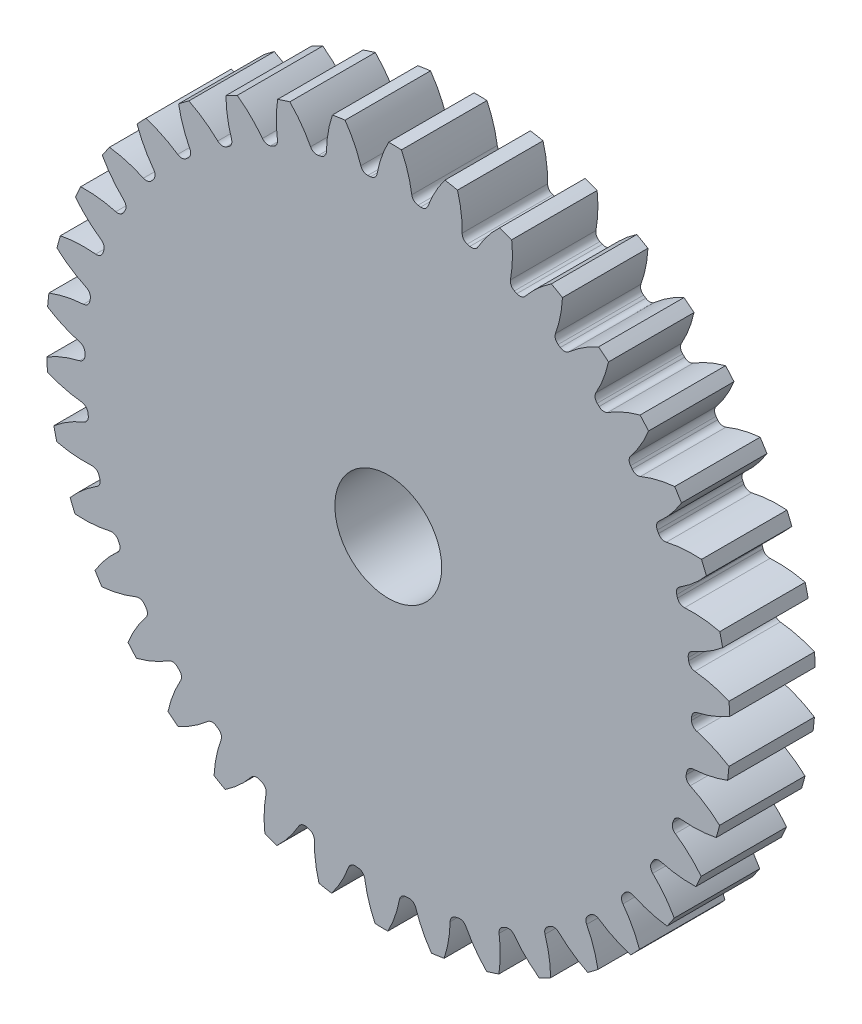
SolidWorks part; units mm, degrees
ref_plane "Front" through (0, 0, 0) normal (0, 0, 1) x (1, 0, 0)
ref_plane "Top" through (0, 0, 0) normal (0, 1, 0) x (1, 0, 0)
ref_plane "Right" through (0, 0, 0) normal (1, 0, 0) x (0, 0, -1)
sketch "Sketch3" plane through (0, 0, 0) normal (0, 0, 1) x (1, 0, 0)
  circle A0 centre (0, 0) radius 406.4
  dimension "od" = 812.8
extrude "gearBody" add sketch "Sketch3" along normal blind 101.6
sketch "Sketch2" plane through (0, 0, 0) normal (0, 0, 1) x (1, 0, 0)
  line L0 (0, 0) -> (335.1803, 138.8362) construction
  line L1 (405.3562, -34.2877) -> (0, 0) construction
  line L2 (0, 0) -> (36.3143, 0) construction
  line L3 (385.9926, 8.2128) -> (385.3596, -23.5747) construction
  line L5 (385.6761, -7.6809) -> (0, 0) construction
  line L7 (0, 0) -> (362.7965, 0) construction
  arc A0 (362.7937, 1.4249) -> (362.4493, -15.8685) centre (0, 0) ccw construction
  arc A1 (406.0061, 17.8896) -> (404.9718, -34.0407) centre (0, 0) ccw construction
  arc A2 (385.9926, 8.2128) -> (385.3596, -23.5747) centre (0, 0) ccw construction
  arc A3 (360.5731, -8.7812) -> (360.6368, -5.5821) centre (0, 0) ccw
  arc A4 (405.3562, -34.2877) -> (366.6425, -16.9553) centre (329.3867, -152.0714) ccw
  arc A5 (405.3562, -34.2877) -> (406.4, 18.1212) centre (0, 0) ccw
  arc A6 (406.4, 18.1212) -> (367.0269, 2.3438) centre (335.1803, 138.8362) cw
  arc A7 (360.6368, -5.5821) -> (367.0269, 2.3438) centre (368.9061, -5.7101) cw
  arc A8 (366.6425, -16.9553) -> (360.5731, -8.7812) centre (368.8409, -8.9826) cw
  point P6 (406.4, 18.1212)
  point P22 (405.3562, -34.2877)
  dimension "baseDia" = 725.5931
  dimension "od" = 812.8
  dimension "pd" = 772.16
  dimension "rd" = 721.36
  dimension "rFillet" = 8.2702
  dimension "pointX" = 406.4
  dimension "pointY" = 18.1212
  dimension "CTT" = 31.7875
  dimension "flankCenterAngle" = 22.5
extrude "toothCut" cut sketch "Sketch2" along normal through all
pattern_circular "CirPattern1" count 38 over 360 about axis through (0, 0, 0) along (0, 0, 1) of "toothCut"
sketch "hub1Dia" plane through (0, 0, 0) normal (0, 0, -1) x (-1, 0, 0)
  circle A0 centre (0, 0) radius 12.7
  dimension "hub1Dia" = 25.4
sketch "hub2Dia" plane through (0, 0, 101.6) normal (0, 0, 1) x (1, 0, 0)
  circle A0 centre (0, 0) radius 12.7
  dimension "hub2dia" = 25.4
sketch "boreDia" plane through (0, 0, 0) normal (0, 0, 1) x (1, 0, 0)
  circle A0 centre (0, 0) radius 63.5
  dimension "boreDia" = 127
extrude "bore" cut sketch "boreDia" against normal mid plane 25400
